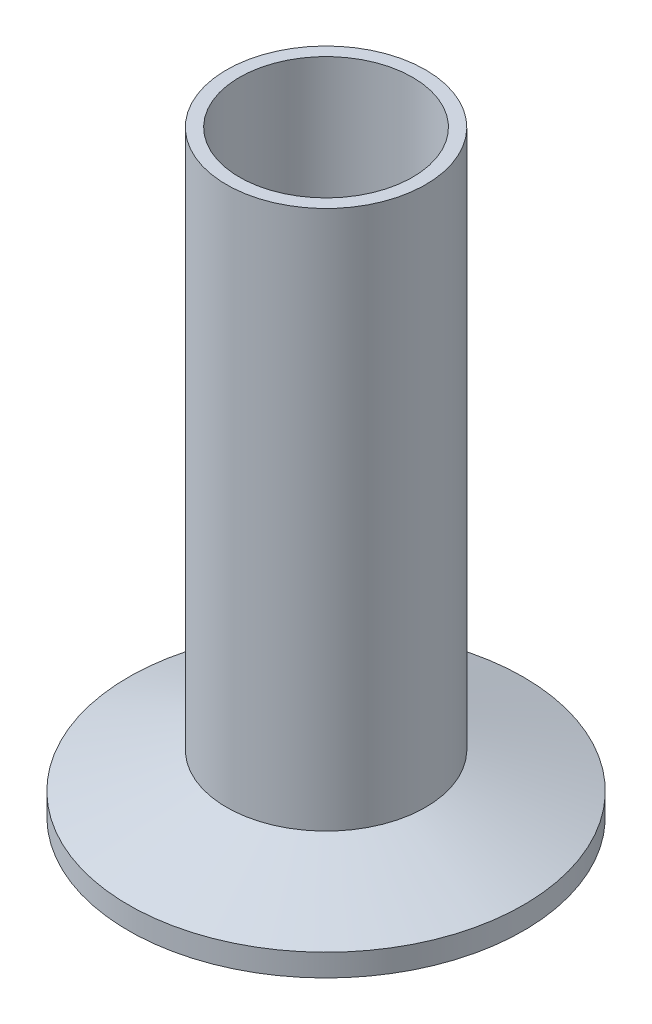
SolidWorks part; units mm, degrees
ref_plane "Front Plane" through (0, 0, 0) normal (0, 0, 1) x (1, 0, 0)
ref_plane "Top Plane" through (0, 0, 0) normal (0, 1, 0) x (1, 0, 0)
ref_plane "Right Plane" through (0, 0, 0) normal (1, 0, 0) x (0, 0, -1)
sketch "Sketch1" plane through (0, 0, 0) normal (0, 0, 1) x (1, 0, 0)
  line L0 (0, 0) -> (0, 76.2) construction
  line L1 (0, 76.2) -> (-12.7, 76.2)
  line L2 (-12.7, 76.2) -> (-12.7, 7.3933)
  line L3 (-12.7, 7.3933) -> (-25.1968, 2.8448)
  line L4 (-25.1968, 2.8448) -> (-25.1968, 0)
  line L5 (-25.1968, 0) -> (-23.6366, 0)
  line L6 (-20.0006, 0) -> (0, 0)
  line L7 (0, 0) -> (0, 76.2)
  line L8 (0, 76.2) -> (-11.049, 76.2)
  line L9 (-11.049, 76.2) -> (-11.049, 0)
  line L10 (-11.049, 0) -> (0, 0)
  line L11 (0, 0) -> (-0.1846, 0.0129)
  arc A0 (-22.9141, 0.4745) -> (-20.7231, 0.4745) centre (-21.8186, 0) cw
  arc A1 (-20.0006, 0) -> (-20.7231, 0.4745) centre (-20.0006, 0.7874) cw
  arc A2 (-22.9141, 0.4745) -> (-23.6366, 0) centre (-23.6366, 0.7874) cw
  point P12 (-20.6248, 0)
  dimension "D6" = 1.1938
  dimension "D7" = 0.7874
  dimension "D1" = 12.7
  dimension "D2" = 2.8448
  dimension "D3" = 25.1968
  dimension "D4" = 70
  dimension "D5" = 21.8186
  dimension "D8" = 1.651
  dimension "D9" = 76.2
revolve "Revolve2" add sketch "Sketch1" angle 360 about L0
